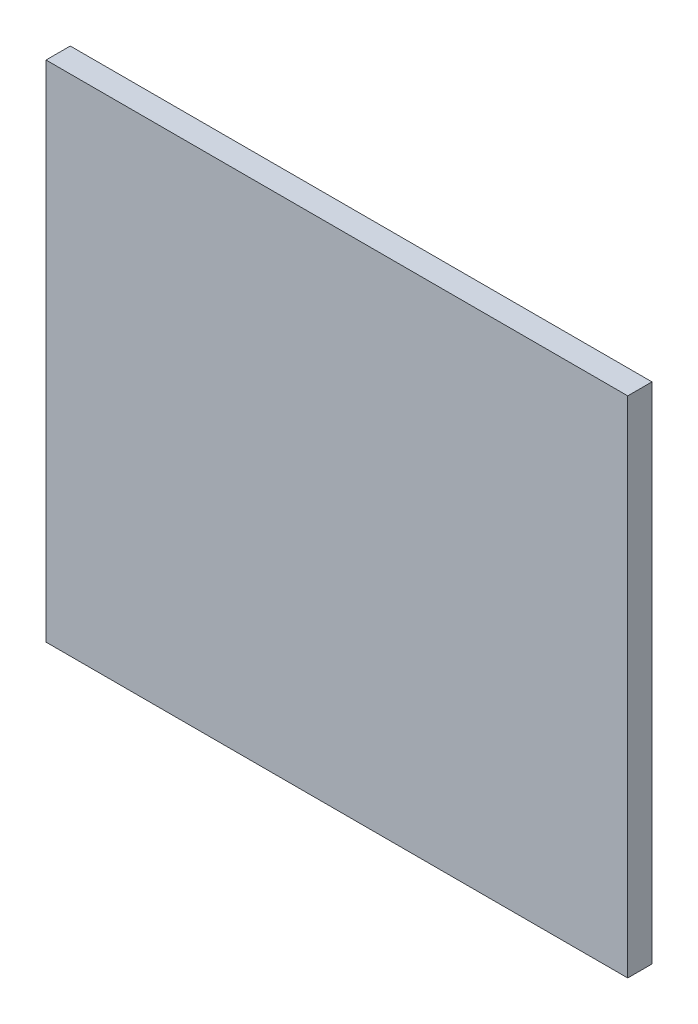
SolidWorks part; units mm, degrees
ref_plane "Front Plane" through (0, 0, 0) normal (0, 0, 1) x (1, 0, 0)
ref_plane "Top Plane" through (0, 0, 0) normal (0, 1, 0) x (1, 0, 0)
ref_plane "Right Plane" through (0, 0, 0) normal (1, 0, 0) x (0, 0, -1)
sketch "Sketch1" plane through (0, 0, 0) normal (0, 0, 1) x (1, 0, 0)
  line L1 (38.1, -33.02) -> (-38.1, -33.02)
  line L2 (38.1, -33.02) -> (38.1, 33.02)
  line L3 (38.1, 33.02) -> (-38.1, 33.02)
  line L4 (-38.1, -33.02) -> (-38.1, 33.02)
  line L5 (38.1, -33.02) -> (-38.1, 33.02) construction
  line L6 (38.1, 33.02) -> (-38.1, -33.02) construction
  point P0 (0, 0)
  dimension "D1" = 76.2
  dimension "D2" = 66.04
extrude "Boss-Extrude1" add sketch "Sketch1" along normal blind 3.175
